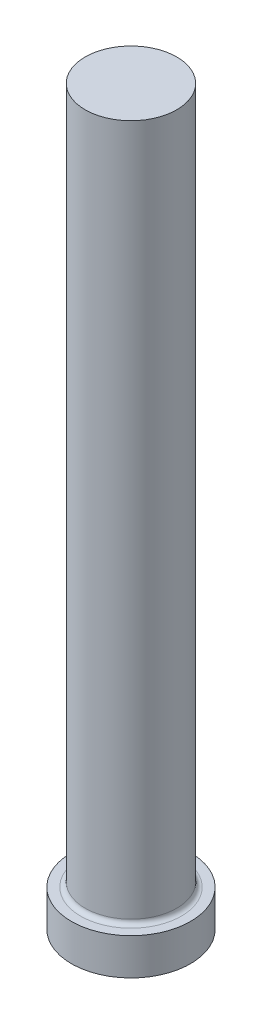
SolidWorks part; units mm, degrees
ref_plane "Plano frontal" through (0, 0, 0) normal (0, 0, 1) x (1, 0, 0)
ref_plane "Plano superior" through (0, 0, 0) normal (0, 1, 0) x (1, 0, 0)
ref_plane "Plano direito" through (0, 0, 0) normal (1, 0, 0) x (0, 0, -1)
sketch "Esboço1" plane through (0, 0, 0) normal (0, 0, 1) x (1, 0, 0)
  line L0 (0, 0) -> (13, 0)
  line L1 (13, 0) -> (13, 8)
  line L2 (13, 8) -> (11, 8)
  line L3 (10, 9) -> (10, 160)
  line L4 (10, 160) -> (0, 160)
  line L5 (0, 160) -> (0, 0) construction
  line L6 (0, 0) -> (0, 160)
  arc A0 (11, 8) -> (10, 9) centre (11, 9) cw
  dimension "D3" = 1
  dimension "D1" = 26
  dimension "D2" = 20
  dimension "D4" = 8
  dimension "D5" = 160
revolve "Revolução1" add sketch "Esboço1" angle 360 about L5
sketch "Esboço2"
  dimension "D1" = 0.975
  dimension "D2" = 2.275
  dimension "D3" = 1.4625
  dimension "D4" = 6.9875
wrap "Envolver1" sketch "Esboço2" wrap type deboss source sketch "Esboço2" thickness 0.1 parameters "D1"=0.1
